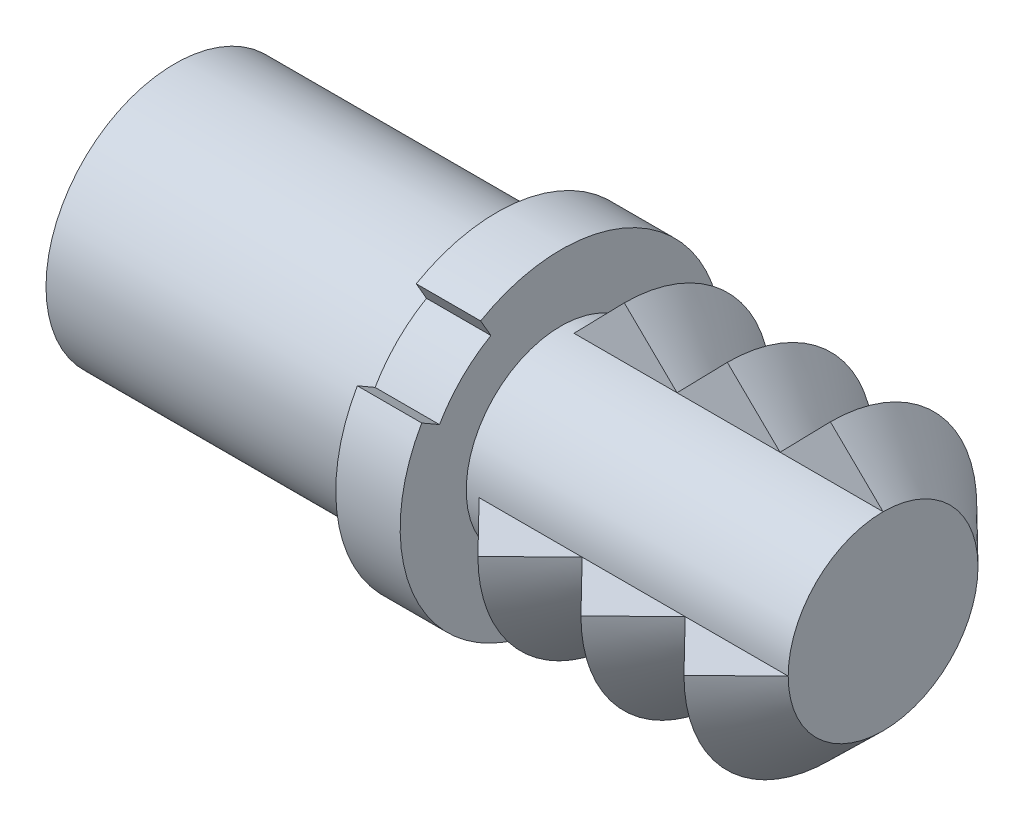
SolidWorks part; units mm, degrees
ref_plane "Front Plane" through (0, 0, 0) normal (0, 0, 1) x (1, 0, 0)
ref_plane "Top Plane" through (0, 0, 0) normal (0, 1, 0) x (1, 0, 0)
ref_plane "Right Plane" through (0, 0, 0) normal (1, 0, 0) x (0, 0, -1)
sketch "Sketch1" plane through (0, 0, 0) normal (0, 0, 1) x (1, 0, 0)
  line L0 (18.8097, -3.5778) -> (18.8097, -7.3213)
  line L2 (-9.1303, -2.2413) -> (-9.1303, -4.7813)
  line L3 (-9.1303, -4.7813) -> (3.5697, -4.7813)
  line L6 (3.5697, -4.7813) -> (3.5697, -7.3213)
  line L11 (18.8097, -3.5778) -> (16.7299, -1.5464)
  line L16 (16.7299, -1.5464) -> (14.7457, -3.5778)
  line L17 (14.7457, -3.5778) -> (12.6659, -1.5464)
  line L18 (12.6659, -1.5464) -> (10.6817, -3.5778)
  line L22 (3.5697, -2.2413) -> (3.5697, -0.9713)
  line L23 (3.5697, -0.9713) -> (6.1097, -0.9713)
  line L26 (6.1097, -0.9713) -> (6.1097, -3.5778)
  line L27 (3.5697, -2.2413) -> (-9.1303, -2.2413)
  line L28 (28.5737, -7.3213) -> (-18.7999, -7.3213) construction
  line L30 (3.5697, -7.3213) -> (18.8097, -7.3213)
  line L32 (10.6817, -3.5778) -> (8.6019, -1.5464)
  line L33 (8.6019, -1.5464) -> (6.6177, -3.5778)
  line L34 (6.1097, -3.5778) -> (6.6177, -3.5778)
  line L35 (18.8097, -3.5778) -> (6.6177, -3.5778) construction
  point P6 (0, 0)
  point P9 (0, 0)
  point P12 (6.1097, -3.5778)
  point P14 (6.1097, -3.5778)
  dimension "D1" = 12.7
  dimension "D2" = 2.54
  dimension "D3" = 4.064
  dimension "D4" = 3.7435
  dimension "D5" = 2.0314
  dimension "D8" = 2.54
  dimension "D9" = 1.27
revolve "Revolve5" add sketch "Sketch1" angle 360 about L28
sketch "Sketch3" plane through (18.8097, 0, 0) normal (1, 0, 0) x (0, 0, -1)
  line L4 (0, -3.5778) -> (0, -1.5464)
  line L5 (-3.7435, -7.3213) -> (-5.7749, -7.3213)
  line L6 (0, -11.0648) -> (0, -13.0963)
  line L7 (3.7435, -7.3213) -> (5.7749, -7.3213)
  circle A0 centre (0, -7.3213) radius 3.7435 construction
  circle A1 centre (0, -7.3213) radius 5.7749 construction
  circle A2 centre (0, -7.3213) radius 5.7749 construction
  arc A3 (0, -3.5778) -> (-3.7435, -7.3213) centre (0, -7.3213) ccw
  arc A5 (3.7435, -7.3213) -> (0, -11.0648) centre (0, -7.3213) cw
  arc A7 (-5.7749, -7.3213) -> (0, -1.5464) centre (0, -7.3213) cw
  arc A8 (5.7749, -7.3213) -> (0, -13.0963) centre (0, -7.3213) cw
extrude "Cut-Extrude2" cut sketch "Sketch3" against normal blind 12.446
sketch "Sketch5" plane through (6.1097, 0, 0) normal (1, 0, 0) x (0, 0, -1)
  line L0 (-5.4993, -4.1463) -> (-4.7993, -4.5505)
  line L1 (-3.175, -1.822) -> (-2.7708, -2.5221)
  line L2 (-5.7749, -7.3213) -> (-3.7435, -7.3213) construction
  circle A0 centre (0, -7.3213) radius 6.35 construction
  arc A1 (-3.175, -1.822) -> (-5.4993, -4.1463) centre (0, -7.3213) ccw
  arc A2 (-2.7708, -2.5221) -> (-4.7993, -4.5505) centre (0, -7.3213) ccw
  dimension "D1" = 30
  dimension "D2" = 30
extrude "Cut-Extrude3" cut sketch "Sketch5" against normal blind 2.54
